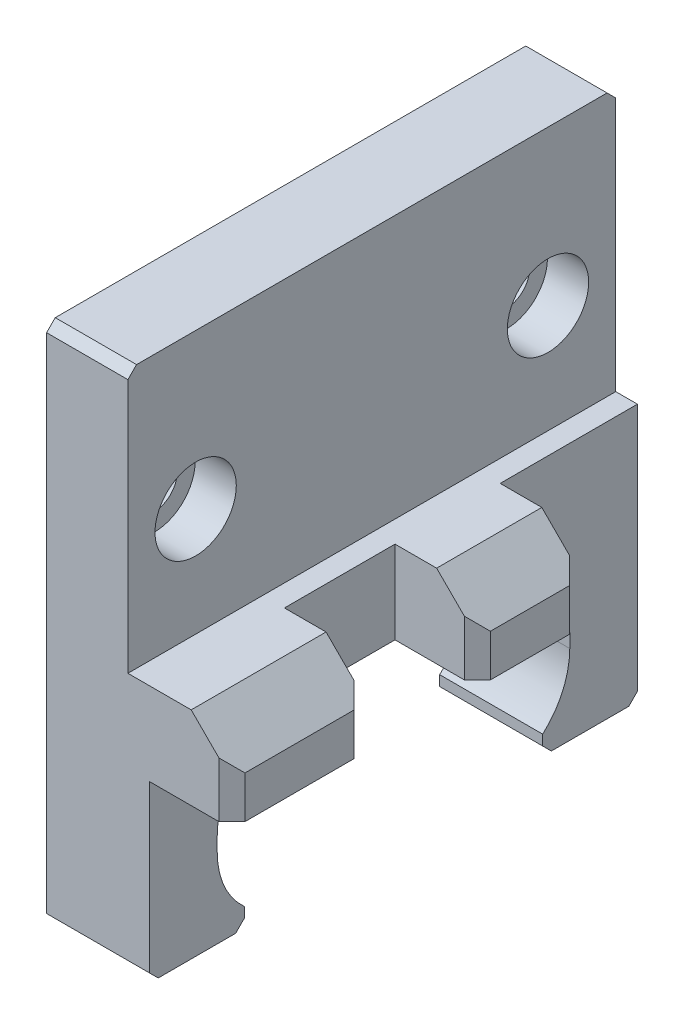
SolidWorks part; units mm, degrees
ref_plane "Plane1" through (0, 0, 0) normal (0, 0, 1) x (1, 0, 0)
ref_plane "Plane2" through (0, 0, 0) normal (0, 1, 0) x (1, 0, 0)
ref_plane "Plane3" through (0, 0, 0) normal (1, 0, 0) x (0, 0, -1)
sketch "Sketch1" plane through (0, 0, 0) normal (0, 0, 1) x (1, 0, 0)
  line L0 (-17.145, -9.3218) -> (-17.145, 51.6382)
  line L1 (-17.145, 51.6382) -> (-7.62, 51.6382)
  line L2 (-7.62, 51.6382) -> (-7.62, 20.828)
  line L3 (-7.62, 20.828) -> (4.572, 20.828)
  line L6 (-5.08, 11.1125) -> (-5.08, -9.3218)
  line L7 (4.572, 20.828) -> (4.572, 11.1125)
  line L8 (-5.08, -9.3218) -> (-17.145, -9.3218)
  line L9 (4.572, 11.1125) -> (-5.08, 11.1125)
  dimension "D7" = 5.08
  dimension "D1" = 17.145
  dimension "D2" = 9.3218
  dimension "D4" = 20.828
  dimension "D5" = 9.525
  dimension "D6" = 60.96
  dimension "D8" = 11.1125
  dimension "D9" = 4.572
extrude "Base-Extrude" add sketch "Sketch1" along normal mid plane 57.15
sketch "Sketch2" plane through (0, 0, 0) normal (1, 0, 0) x (0, 0, -1)
  line L0 (-28.575, 11.1125) -> (28.575, 11.1125) construction
  line L1 (-17.4752, -9.3218) -> (17.4752, -9.3218)
  line L2 (-20.6502, 1.5875) -> (-20.6502, 0)
  line L3 (-17.4752, -9.3218) -> (-17.4752, -7.0995)
  line L4 (17.4752, -9.3218) -> (17.4752, -7.0995)
  line L5 (-28.575, -9.3218) -> (28.575, -9.3218) construction
  line L6 (-11.1252, 11.1125) -> (11.1252, 11.1125)
  line L7 (20.6502, 1.5875) -> (20.6502, 0)
  line L8 (-28.575, 20.828) -> (28.575, 20.828) construction
  line L11 (0, 0) -> (0, 23.7494) construction
  arc A0 (-20.6502, 1.5875) -> (-11.1252, 11.1125) centre (-11.1252, 1.5875) cw
  arc A1 (20.6502, 0) -> (17.4752, -7.0995) centre (11.1252, 0) cw
  arc A2 (-20.6502, 0) -> (-17.4752, -7.0995) centre (-11.1252, 0) ccw
  arc A3 (20.6502, 1.5875) -> (11.1252, 11.1125) centre (11.1252, 1.5875) ccw
  dimension "D4" = 11.1252
  dimension "D2" = 20.828
  dimension "D3" = 9.525
  dimension "D1" = 17.4752
extrude "Cut-Extrude1" cut sketch "Sketch2" against normal through all
chamfer "Chamfer1" distance 1.016 angle 45 6 edges at (-12.3825, 51.6382, 28.575) (-11.1125, -9.3218, 17.4752) (-11.1125, -9.3218, -17.4752) (-11.1125, -9.3218, 28.575) (-12.3825, 51.6382, -28.575) (-11.1125, -9.3218, -28.575)
sketch "Sketch5" plane through (0, 11.1125, 0) normal (0, -1, 0) x (1, 0, 0)
  line L0 (4.572, -0.1778) -> (-5.08, -0.1778)
  line L1 (4.572, 28.575) -> (4.572, -28.575) construction
  line L2 (4.572, 12.7762) -> (-5.08, 12.7762)
  line L4 (-5.08, 12.7762) -> (-5.08, -0.1778)
  line L5 (4.572, 12.7762) -> (4.572, -0.1778)
  line L8 (4.572, -12.4968) -> (-5.08, -12.4968)
  line L9 (4.572, -12.4968) -> (4.572, -28.575)
  line L10 (4.572, -28.575) -> (-5.08, -28.575)
  line L11 (-5.08, -12.4968) -> (-5.08, -28.575)
  dimension "D1" = 12.954
  dimension "D2" = 12.319
  dimension "D3" = 0.1778
extrude "Lock Cut-Extrude4" cut sketch "Sketch5" against normal through all
chamfer "Chamfer2" distance 1.524 angle 45 4 edges at (4.572, 15.9702, 12.7762) (4.572, 15.9702, -0.1778) (4.572, 15.9702, -12.4968) (4.572, 15.9702, 28.575)
chamfer "Chamfer4" distance 4.7752 angle 45 6 edges at (4.572, 20.828, 20.6756) (4.572, 20.828, -6.3373) (3.81, 20.828, -11.7348) (3.81, 20.828, -0.9398) (3.81, 20.828, 13.5382) (3.81, 20.828, 27.813)
hole_wizard "CBORE for #10 Socket Head Cap Screw1" positions "Sketch9" profile "Sketch8" counterbore size "#10" standard "Ansi Inch"
sketch "Sketch9" plane through (-7.62, 0, 0) normal (1, 0, 0) x (0, 0, -1)
  line L0 (-28.575, 20.828) -> (-12.7762, 20.828) construction
  line L1 (-28.575, 20.828) -> (-28.575, 50.6222) construction
  line L2 (28.575, 20.828) -> (28.575, 50.6222) construction
  point P0 (20.6375, 33.528)
  point P1 (-20.6375, 33.528)
  dimension "D1" = 12.7
  dimension "D2" = 7.9375
  dimension "D3" = 7.9375
sketch "Sketch8" plane through (-7.62, 33.528, -20.6375) normal (0, 1, 0) x (0, 0, -1)
  line L0 (0, 0) -> (0, 9.525)
  line L1 (0, 9.525) -> (2.667, 9.525)
  line L3 (2.667, 9.525) -> (2.667, 4.826)
  line L4 (2.667, 4.826) -> (4.7625, 4.826)
  line L5 (4.7625, 4.826) -> (4.7625, 0)
  line L7 (4.7625, 0) -> (0, 0)
  line L11 (0, -6.35) -> (0, 107.95) construction
  dimension "Thru Hole Dia." = 5.334
  dimension "Thru Hole Depth" = 9.525
  dimension "C'Bore Dia." = 9.525
  dimension "C'Bore Depth" = 4.826
